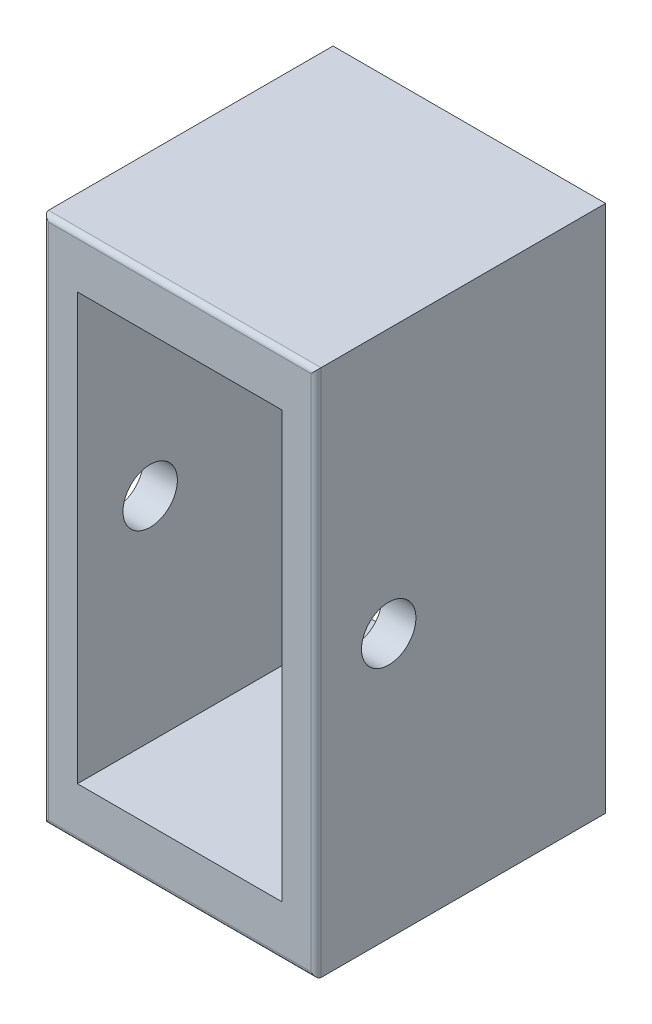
SolidWorks part; units mm, degrees
ref_plane "Plan de face" through (0, 0, 0) normal (0, 0, 1) x (1, 0, 0)
ref_plane "Plan de dessus" through (0, 0, 0) normal (0, 1, 0) x (1, 0, 0)
ref_plane "Plan de droite" through (0, 0, 0) normal (1, 0, 0) x (0, 0, -1)
sketch "Esquisse1" plane through (0, 0, 0) normal (0, 0, 1) x (1, 0, 0)
  line L0 (14, 3) -> (14, 28)
  line L1 (0, 0) -> (16, 0)
  line L2 (0, 0) -> (0, 31)
  line L3 (0, 31) -> (16, 31)
  line L4 (16, 0) -> (16, 31)
  line L5 (2, 3) -> (2, 28)
  line L6 (2, 28) -> (14, 28)
  line L7 (2, 3) -> (14, 3)
  line L8 (0, 28) -> (16, 28) construction
  line L9 (14, 0) -> (14, 31) construction
  line L10 (2, 0) -> (2, 31) construction
  line L11 (0, 3) -> (16, 3) construction
  dimension "D1" = 31
  dimension "D2" = 16
  dimension "D3" = 2
  dimension "D4" = 2
  dimension "D5" = 3
  dimension "D6" = 3
extrude "Extrusion1" add sketch "Esquisse1" along normal blind 17
fillet "Congé1" radius 0.3 4 edges at (0, 15.5, 17) (8, 0, 17) (16, 15.5, 17) (8, 31, 17)
sketch "Esquisse2" plane through (16, 0, 0) normal (1, 0, 0) x (0, 0, -1)
  line L0 (0, 15.5) -> (-16.7, 15.5) construction
  line L1 (0, 0) -> (0, 31) construction
  line L2 (-16.7, 31) -> (-16.7, 0) construction
  circle A0 centre (-12.732, 15.5) radius 1.5977
extrude "Enlèv. mat.-Extru.1" cut sketch "Esquisse2" against normal through all
